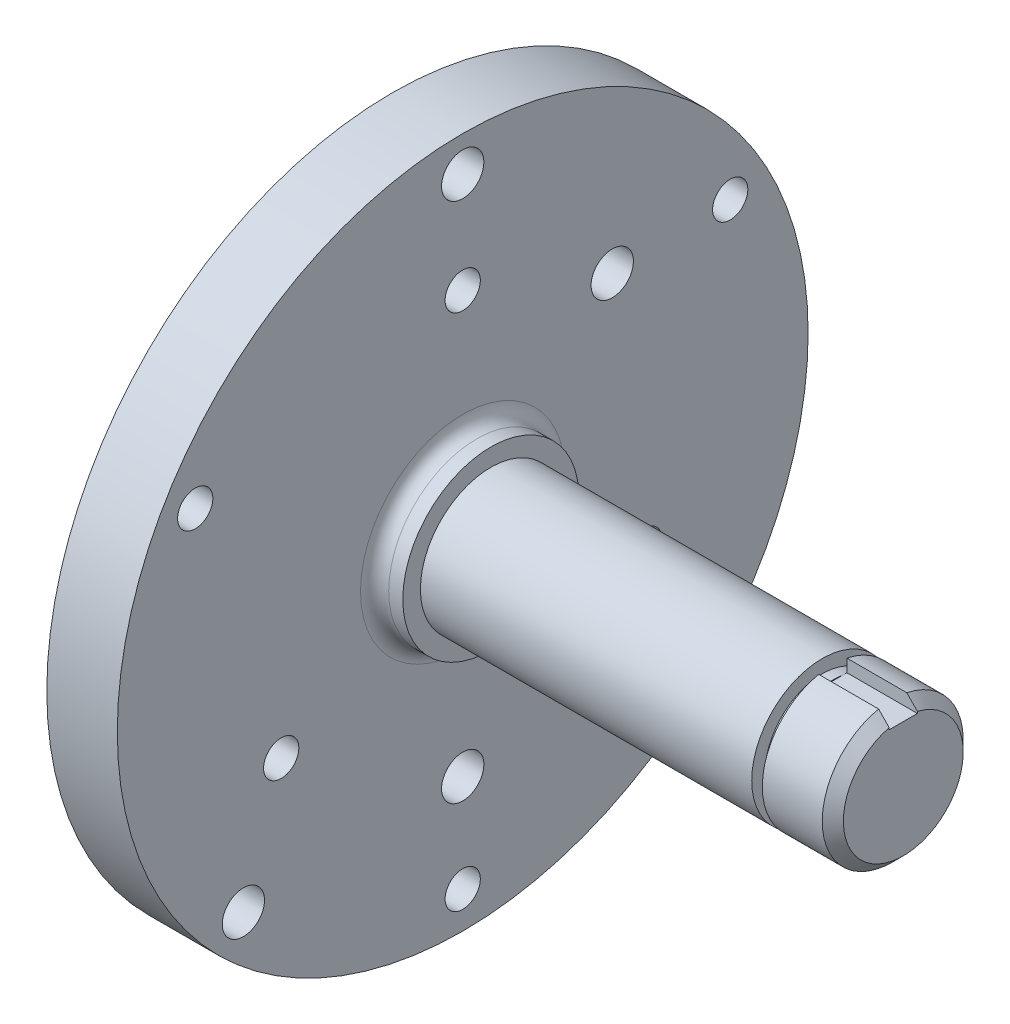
SolidWorks part; units mm, degrees
ref_plane "Plan de face" through (0, 0, 0) normal (0, 0, 1) x (1, 0, 0)
ref_plane "Plan de dessus" through (0, 0, 0) normal (0, 1, 0) x (1, 0, 0)
ref_plane "Plan de droite" through (0, 0, 0) normal (1, 0, 0) x (0, 0, -1)
sketch "Esquisse1" plane through (0, 0, 0) normal (0, 0, 1) x (1, 0, 0)
  line L0 (-18.2864, 0) -> (63.7946, 0) construction
  line L1 (-14, 0) -> (-14, 49)
  line L2 (-14, 49) -> (-4, 49)
  line L3 (-4, 49) -> (-4, 14.5)
  line L4 (-2, 12.5) -> (0, 12.5)
  line L5 (0, 12.5) -> (0, 10)
  line L6 (0, 10) -> (47, 10)
  line L7 (47, 10) -> (47, 8.1277)
  line L8 (47, 8.1277) -> (48.5, 8.1277)
  line L9 (48.5, 8.1277) -> (48.5, 10)
  line L10 (48.5, 10) -> (57, 10)
  line L11 (58.5, 8.5) -> (58.5, 0)
  line L12 (57, 10) -> (58.5, 8.5)
  line L13 (-14, 0) -> (58.5, 0)
  arc A0 (-4, 14.5) -> (-2, 12.5) centre (-2, 14.5) ccw
  point P14 (58.5, 10)
  dimension "D9" = 2
  dimension "D1" = 98
  dimension "D2" = 25
  dimension "D3" = 20
  dimension "D4" = 10
  dimension "D5" = 14
  dimension "D6" = 47
  dimension "D7" = 1.5
  dimension "D8" = 58.5
  dimension "D10" = 1.5
  dimension "D11" = 45
revolve "Révolution1" add sketch "Esquisse1" angle 360 about L0
sketch "Esquisse2" plane through (-14, 0, 0) normal (-1, 0, 0) x (0, 0, 1)
  line L0 (-51.6268, 0) -> (51.8086, 0) construction
  line L1 (0, 61.2669) -> (0, -61.2669) construction
  line L2 (0, 0) -> (-21.2132, 21.2132) construction
  line L3 (0, 0) -> (31.1127, -31.1127) construction
  circle A0 centre (0, -30) radius 3
  circle A1 centre (-21.2132, 21.2132) radius 3
  circle A2 centre (0, 44) radius 3
  circle A3 centre (31.1127, -31.1127) radius 3
  dimension "D1" = 6
  dimension "D2" = 45
  dimension "D3" = 30
  dimension "D4" = 30
  dimension "D5" = 44
  dimension "D6" = 45
  dimension "D7" = 44
extrude "Enlèv. mat.-Extru.1" cut sketch "Esquisse2" against normal up to next
hole_wizard "Trou taraudé M61" positions "Esquisse3D1" profile "Esquisse3" tap size "M6" standard "ISO"
sketch3d "Esquisse3D1"
  point P0 (-4, 29.7321, 0)
  point P2 (-4, -43.8178, 0)
  dimension "D1" = 44
  dimension "D2" = 30
sketch "Esquisse3" plane through (-4, 29.7321, 0) normal (0, 1, 0) x (0, 0, -1)
  line L0 (0, 0) -> (0, 10)
  line L1 (0, 10) -> (2.5, 10)
  line L2 (2.5, 10) -> (2.5, 0)
  line L5 (2.5, 0) -> (0, 0)
  line L11 (0, -6.35) -> (0, 107.95) construction
  dimension "Diamètre du trou pour taraudage jusqu'au prochain" = 5
  dimension "Profondeur du trou pour taraudage jusqu'au prochain" = 10
pattern_circular "Répétition circulaire1" count 3 every 120 about axis through (0, 0, 0) along (1, 0, 0) of "Trou taraudé M61"
sketch "Esquisse4" plane through (58.5, 0, 0) normal (1, 0, 0) x (0, 0, -1)
  line L1 (-2, 12.2319) -> (2, 12.2319)
  line L2 (-2, 12.2319) -> (-2, 8)
  line L3 (-2, 8) -> (2, 8)
  line L4 (2, 12.2319) -> (2, 8)
  dimension "D1" = 8
  dimension "D2" = 4
  dimension "D3" = 2
extrude "Enlèv. mat.-Extru.4" cut sketch "Esquisse4" against normal up to surface (10 mm away)
